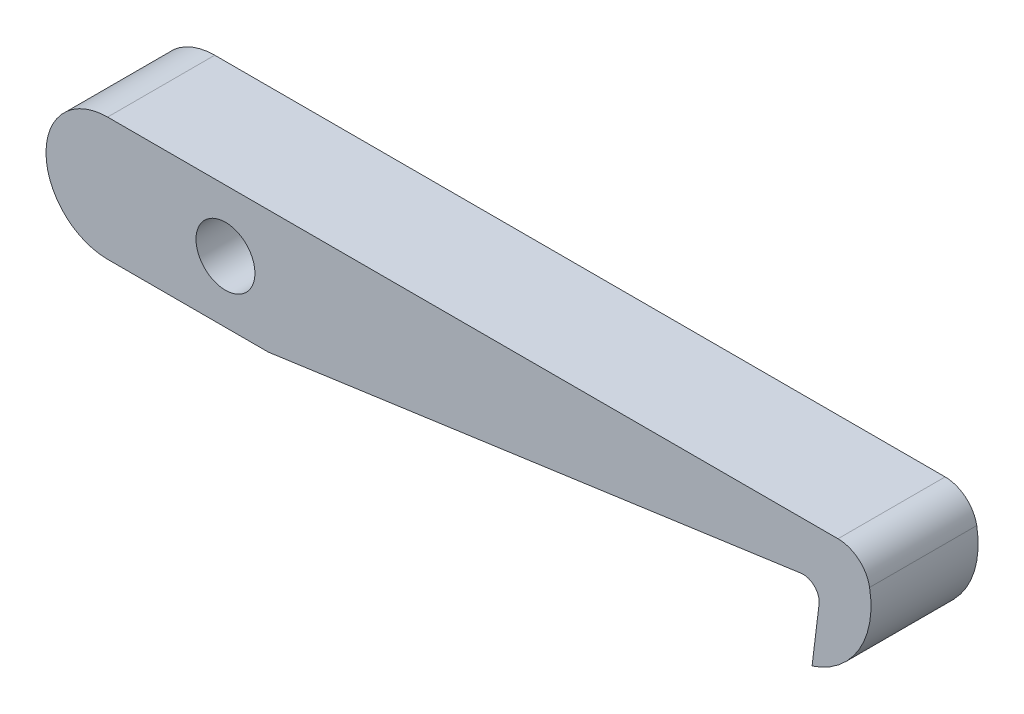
SolidWorks part; units mm, degrees
ref_plane "Vorne" through (0, 0, 0) normal (0, 0, 1) x (1, 0, 0)
ref_plane "Oben" through (0, 0, 0) normal (0, 1, 0) x (1, 0, 0)
ref_plane "Rechts" through (0, 0, 0) normal (1, 0, 0) x (0, 0, -1)
sketch "Skizze1" plane through (0, 0, 0) normal (0, 0, 1) x (1, 0, 0)
  line L0 (-11, 5.75) -> (57.1683, 5.75)
  line L1 (54.7484, -5.75) -> (55.4013, -0.4328)
  line L2 (53.7037, 1.2354) -> (4, -5.75)
  line L3 (4, -5.75) -> (-11, -5.75)
  arc A0 (57.1683, 5.75) -> (60.1193, 3.2901) centre (57.1683, 2.75) cw
  circle A1 centre (0, 0) radius 2.75
  arc A2 (-11, -5.75) -> (-11, 5.75) centre (-11, 0) cw
  arc A3 (55.4013, -0.4328) -> (53.7037, 1.2354) centre (53.9125, -0.25) ccw
  arc A4 (54.7484, -5.75) -> (60.1193, 3.2901) centre (52.25, 1.8499) ccw
  dimension "D1" = 3
  dimension "D4" = 11
  dimension "D5" = 5.5
  dimension "D8" = 1.5
  dimension "D2" = 8
  dimension "D9" = 77
  dimension "D12" = 6
  dimension "D3" = 11.5
  dimension "D6" = 75
  dimension "D7" = 15
  dimension "D10" = 8
  dimension "D11" = 11.5
extrude "Linear austragen1" add sketch "Skizze1" along normal blind 10
sketch "Skizze2" plane through (0, 0, 10) normal (0, 0, 1) x (1, 0, 0)
  line L0 (0, 0) -> (20.5513, 0) construction
  line L1 (0, 0) -> (0, 9.4159) construction
sketch "Skizze3" [suppressed] plane through (0, 0, 10) normal (0, 0, 1) x (1, 0, 0)
  line L0 (-11, 0) -> (0, 0) construction
  line L1 (-11, 2.75) -> (0, 2.75)
  line L2 (-11, -2.75) -> (0, -2.75)
  arc A0 (-11, 2.75) -> (-11, -2.75) centre (-11, 0) ccw
  arc A1 (0, -2.75) -> (0, 2.75) centre (0, 0) ccw
  circle A2 centre (0, 0) radius 2.75 construction
  point P4 (-5.5, 0)
extrude "Schnitt-Linear austragen1" [suppressed] cut sketch "Skizze3" against normal through all
